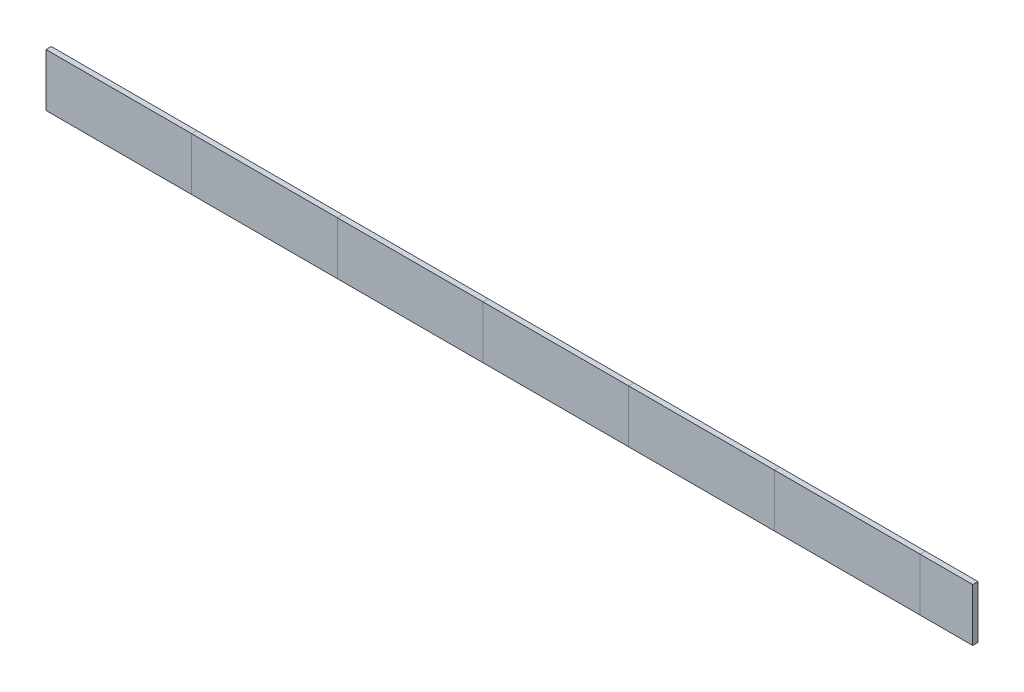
SolidWorks part; units mm, degrees
ref_plane "Front" through (0, 0, 0) normal (0, 0, 1) x (1, 0, 0)
ref_plane "Top" through (0, 0, 0) normal (0, 1, 0) x (1, 0, 0)
ref_plane "Right" through (0, 0, 0) normal (1, 0, 0) x (0, 0, -1)
ref_plane "Plane1" through (0, 0, -10) normal (0, 0, 1) x (1, 0, 0)
sketch "Sketch1" plane through (0, 0, -10) normal (0, 0, 1) x (1, 0, 0)
  line L0 (27.6, 5) -> (55.2, 5)
  line L1 (0, -5) -> (27.6, -5)
  line L2 (0, -5) -> (0, 5)
  line L3 (0, 5) -> (27.6, 5)
  line L4 (27.6, -5) -> (27.6, 5) construction
  line L5 (55.2, 5) -> (55.2, -5) construction
  line L6 (55.2, -5) -> (27.6, -5)
  line L7 (55.2, 5) -> (82.8, 5)
  line L8 (82.8, 5) -> (82.8, -5) construction
  line L9 (82.8, -5) -> (55.2, -5)
  line L10 (82.8, -5) -> (110.4, -5)
  line L11 (110.4, -5) -> (110.4, 5) construction
  line L12 (110.4, 5) -> (82.8, 5)
  line L13 (110.4, 5) -> (138, 5)
  line L14 (138, 5) -> (138, -5) construction
  line L15 (138, -5) -> (110.4, -5)
  line L16 (138, 5) -> (165.6, 5)
  line L17 (165.6, 5) -> (165.6, -5) construction
  line L18 (165.6, -5) -> (138, -5)
  line L19 (165.6, 5) -> (175.6, 5)
  line L20 (175.6, 5) -> (175.6, -5)
  line L21 (175.6, -5) -> (165.6, -5)
  point P4 (0, 0)
  point P14 (193.2, 22.3469)
  dimension "D1" = 27.6
  dimension "D2" = 10
  dimension "D3" = 10
surface "Surface-Plane1" sketch "Sketch1"
sketch "Sketch2" plane through (0, 0, -10) normal (0, 0, 1) x (1, 0, 0)
  line L1 (0, 5) -> (27.6, 5)
  line L2 (0, 5) -> (0, -5)
  line L3 (0, -5) -> (27.6, -5)
  line L4 (27.6, 5) -> (27.6, -5)
sketch "Sketch3" plane through (0, 0, -10) normal (0, 0, 1) x (1, 0, 0)
  line L1 (27.6, 5) -> (55.2, 5)
  line L2 (27.6, 5) -> (27.6, -5)
  line L3 (27.6, -5) -> (55.2, -5)
  line L4 (55.2, 5) -> (55.2, -5)
sketch "Sketch4" plane through (0, 0, -10) normal (0, 0, 1) x (1, 0, 0)
  line L1 (55.2, 5) -> (82.8, 5)
  line L2 (55.2, 5) -> (55.2, -5)
  line L3 (55.2, -5) -> (82.8, -5)
  line L4 (82.8, 5) -> (82.8, -5)
sketch "Sketch5" plane through (0, 0, -10) normal (0, 0, 1) x (1, 0, 0)
  line L1 (82.8, 5) -> (110.4, 5)
  line L2 (82.8, 5) -> (82.8, -5)
  line L3 (82.8, -5) -> (110.4, -5)
  line L4 (110.4, 5) -> (110.4, -5)
sketch "Sketch6" plane through (0, 0, -10) normal (0, 0, 1) x (1, 0, 0)
  line L1 (110.4, 5) -> (138, 5)
  line L2 (110.4, 5) -> (110.4, -5)
  line L3 (110.4, -5) -> (138, -5)
  line L4 (138, 5) -> (138, -5)
sketch "Sketch7" plane through (0, 0, -10) normal (0, 0, 1) x (1, 0, 0)
  line L1 (138, 5) -> (165.6, 5)
  line L2 (138, 5) -> (138, -5)
  line L3 (138, -5) -> (165.6, -5)
  line L4 (165.6, 5) -> (165.6, -5)
surface "Surface-Offset1" parameters "D1"=10
surface "Surface-Offset2" parameters "D1"=10
surface "Surface-Offset3" parameters "D1"=10
surface "Surface-Offset4" parameters "D1"=10
surface "Surface-Offset5" parameters "D1"=10
surface "Surface-Offset6" parameters "D1"=10
surface "Surface-Offset7" parameters "D1"=10
thicken "Thicken1" thickness 0.5 thickness side both sides parameters "D1"=0.5
thicken "Thicken2" thickness 0.5 thickness side both sides parameters "D1"=0.5
thicken "Thicken3" thickness 0.5 thickness side both sides parameters "D1"=0.5
thicken "Thicken4" thickness 0.5 thickness side both sides parameters "D1"=0.5
thicken "Thicken5" thickness 0.5 thickness side both sides parameters "D1"=0.5
thicken "Thicken6" thickness 0.5 thickness side both sides parameters "D1"=0.5
thicken "Thicken7" thickness 0.5 thickness side both sides parameters "D1"=0.5
other "Save Bodies1"
